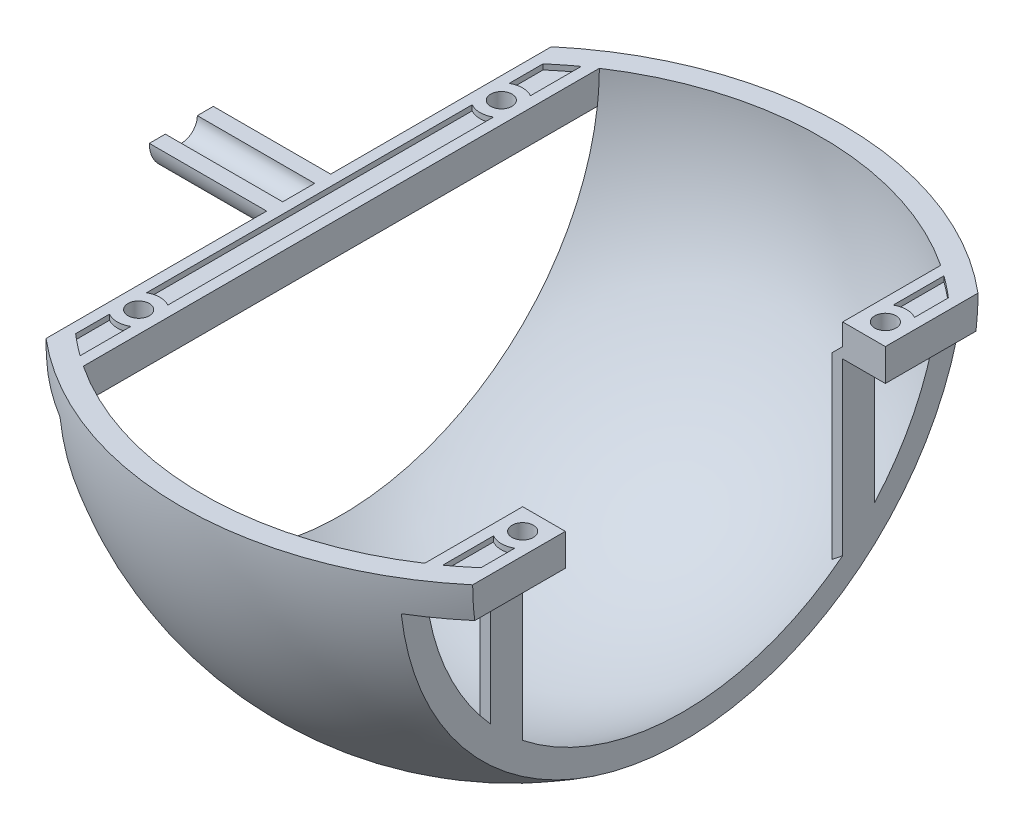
SolidWorks part; units mm, degrees
ref_plane "Plan de face" through (0, 0, 0) normal (0, 0, 1) x (1, 0, 0)
ref_plane "Plan de dessus" through (0, 0, 0) normal (0, 1, 0) x (1, 0, 0)
ref_plane "Plan de droite" through (0, 0, 0) normal (1, 0, 0) x (0, 0, -1)
sketch "Esquisse1" plane through (0, 0, 0) normal (0, 0, 1) x (1, 0, 0)
  line L0 (-40.0294, 0) -> (38.3658, 0) construction
  line L1 (-20, 0) -> (20, 0)
  line L2 (0, 0) -> (0, 37.8329) construction
  line L3 (20, 23.6854) -> (20, 0)
  line L4 (-20, 23.6854) -> (-20, 0)
  arc A0 (20, 23.6854) -> (-20, 23.6854) centre (0, 0) ccw
  dimension "D1" = 31
  dimension "D2" = 40
revolve "Révolution1" add sketch "Esquisse1" angle 360 about L0
sketch "Esquisse2" plane through (0, 0, 0) normal (1, 0, 0) x (0, 0, -1)
  line L0 (-37.5163, 0) -> (36.1663, 0)
extrude "Enlèv. mat.-Extru.1" cut sketch "Esquisse2" against normal through all and the other way through all
sketch "Esquisse3" plane through (0, 0, 0) normal (0, 0, 1) x (1, 0, 0)
  line L0 (20, -23.6854) -> (20, 0) construction
  line L1 (20, -23.6854) -> (20, -3)
  line L2 (-20, 0) -> (-20, -23.6854) construction
  line L3 (-20, -3) -> (-20, -23.6854)
  line L4 (0, 0) -> (0, -18.8748) construction
  line L5 (20, -3) -> (16, -3)
  line L6 (16, -3) -> (16, -26.5518)
  line L7 (-16, -3) -> (-16, -26.5518)
  line L8 (-20, -3) -> (-16, -3)
  line L9 (20, 0) -> (-20, 0) construction
  arc A0 (-20, -23.6854) -> (20, -23.6854) centre (0, 0) ccw construction
  arc A1 (-20, -23.6854) -> (-16, -26.5518) centre (0, 0) ccw
  arc A2 (16, -26.5518) -> (20, -23.6854) centre (0, 0) ccw
  dimension "D1" = 32
  dimension "D2" = 3
extrude "Enlèv. mat.-Extru.2" cut sketch "Esquisse3" against normal through all and the other way through all
sketch "Esquisse4" plane through (0, 0, 0) normal (0, 0, 1) x (1, 0, 0)
  line L0 (20, 0) -> (-20, 0) construction
  line L1 (21.7251, 0) -> (-21.2095, 0) construction
  line L4 (16, -26.5518) -> (16, -3) construction
  line L5 (-16, 0) -> (-16, -24.1868)
  line L6 (16, 0) -> (-16, 0)
  line L7 (-16, -3) -> (-16, -26.5518) construction
  line L8 (16, -24.1868) -> (16, 0)
  arc A2 (-14.9677, -24.8388) -> (14.9677, -24.8388) centre (0, 0) ccw
  arc A3 (-16, -24.1868) -> (16, -24.1868) centre (0, 0) ccw
  dimension "D1" = 2
revolve "Enlèvement de matière-Révolution1" cut sketch "Esquisse4" angle 360 about L1
sketch "Esquisse5" plane through (16, 0, 0) normal (1, 0, 0) x (0, 0, -1)
  line L0 (-23.6854, 0) -> (23.6854, 0) construction
  line L1 (-15, 0) -> (15, 0)
  line L2 (-15, 0) -> (-15, -3)
  line L3 (-15, -3) -> (15, -3)
  line L4 (15, 0) -> (15, -3)
  line L5 (-23.4947, -3) -> (23.4947, -3) construction
  dimension "D1" = 30
extrude "Enlèv. mat.-Extru.3" cut sketch "Esquisse5" along normal up to next
sketch "Esquisse6" plane through (0, 0, 0) normal (0, 1, 0) x (-1, 0, 0)
  line L0 (-18, 15) -> (-18, 20.7536) construction
  line L1 (-20, 15) -> (-16, 15) construction
  line L2 (0, 0) -> (-24.2669, 0) construction
  circle A0 centre (-18, -17) radius 1
  circle A1 centre (-18, 17) radius 1
  dimension "D1" = 2
  dimension "D2" = 34
extrude "Enlèv. mat.-Extru.4" cut sketch "Esquisse6" against normal up to next
mirror "Symétrie1" about plane through (0, 0, 0) normal (1, 0, 0) of "Enlèv. mat.-Extru.4"
sketch "Esquisse7" plane through (0, 0, 0) normal (0, 1, 0) x (-1, 0, 0)
  line L15 (-19, -15) -> (-19, -23.6854)
  line L16 (-19, -18.7321) -> (-19, -21.9089)
  line L18 (-17, -24.1868) -> (-17, -15)
  line L19 (-17, -23.4947) -> (-17, -18.7321)
  arc A0 (-16, -24.1868) -> (16, -24.1868) centre (0, 0) ccw construction
  arc A1 (-19, -21.9089) -> (-17, -23.4947) centre (0, 0) ccw
  circle A4 centre (-18, -17) radius 2
  arc A5 (-19, -18.7321) -> (-17, -18.7321) centre (-18, -17) ccw
  dimension "D1" = 1
  dimension "D2" = 1
  dimension "D3" = 1
extrude "Enlèv. mat.-Extru.5" cut sketch "Esquisse7" against normal blind 0.5
sketch "Esquisse8" plane through (0, -3, 0) normal (0, -1, 0) x (1, 0, 0)
  line L2 (19, -21.9089) -> (19, -18.7321)
  line L3 (17, -18.7321) -> (17, -23.4947)
  line L4 (19, -21.9089) -> (19, -18.7321)
  line L5 (17, -18.7321) -> (17, -23.4947)
  arc A2 (17, -23.4947) -> (19, -21.9089) centre (0, 0) ccw
  arc A3 (17, -18.7321) -> (19, -18.7321) centre (18, -17) ccw
  arc A4 (17, -23.4947) -> (19, -21.9089) centre (0, 0) ccw
  arc A5 (17, -18.7321) -> (19, -18.7321) centre (18, -17) ccw
  dimension "D1" = 0
extrude "Enlèv. mat.-Extru.6" cut sketch "Esquisse8" against normal blind 0.5
ref_plane "Plan1" through (0, -2, 0) normal (0, 1, 0) x (-1, 0, 0)
sketch "Esquisse9" plane through (0, -2, 0) normal (0, 1, 0) x (-1, 0, 0)
  line L1 (-16, -15) -> (-15, -15)
  line L2 (-16, -15) -> (-16, -18)
  line L3 (-16, -18) -> (-15, -18)
  line L4 (-15, -15) -> (-15, -18)
  dimension "D1" = 1
  dimension "D2" = 3
extrude "Extrusion1" add sketch "Esquisse9" against normal up to next
chamfer "Chanfrein1" distance 1 angle 45 1 edges at (15, -2, -16.5)
mirror "Symétrie3" about plane through (0, 0, 0) normal (0, 0, 1) of "Chanfrein1", "Extrusion1", "Enlèv. mat.-Extru.6", "Enlèv. mat.-Extru.5"
sketch "Esquisse10" plane through (0, 0, 0) normal (0, 1, 0) x (-1, 0, 0)
  line L2 (17, 24.1868) -> (17, -24.1868)
  line L3 (17, 23.4947) -> (17, 18.7321)
  line L4 (17, 15.2679) -> (17, -15.2679)
  line L5 (19, -23.6854) -> (19, 23.6854)
  line L6 (19, -21.9089) -> (19, -18.7321)
  line L7 (19, 18.7321) -> (19, 21.9089)
  line L8 (17, -18.7321) -> (17, -23.4947)
  line L9 (19, -15.2679) -> (19, 15.2679)
  arc A0 (-16, -24.1868) -> (16, -24.1868) centre (0, 0) ccw construction
  arc A1 (17, -23.4947) -> (19, -21.9089) centre (0, 0) ccw
  circle A9 centre (18, -17) radius 2
  arc A10 (19, -15.2679) -> (17, -15.2679) centre (18, -17) ccw
  arc A11 (16, 24.1868) -> (-16, 24.1868) centre (0, 0) ccw construction
  circle A12 centre (18, 17) radius 2
  arc A13 (19, 18.7321) -> (17, 18.7321) centre (18, 17) ccw
  arc A14 (19, 21.9089) -> (17, 23.4947) centre (0, 0) ccw
  arc A15 (17, 15.2679) -> (19, 15.2679) centre (18, 17) ccw
  arc A16 (17, -18.7321) -> (19, -18.7321) centre (18, -17) ccw
  dimension "D1" = 1
  dimension "D2" = 1
  dimension "D3" = 1
  dimension "D4" = 1
extrude "Enlèv. mat.-Extru.7" cut sketch "Esquisse10" against normal blind 0.5
sketch "Esquisse11" plane through (0, -3, 0) normal (0, -1, 0) x (1, 0, 0)
  line L2 (-19, -18.7321) -> (-19, -21.9089)
  line L3 (-17, -23.4947) -> (-17, -18.7321)
  line L4 (-19, -18.7321) -> (-19, -21.9089)
  line L5 (-17, -23.4947) -> (-17, -18.7321)
  line L6 (-19, 15.2679) -> (-19, -15.2679)
  line L7 (-17, -15.2679) -> (-17, 15.2679)
  line L8 (-19, 15.2679) -> (-19, -15.2679)
  line L9 (-17, -15.2679) -> (-17, 15.2679)
  line L10 (-17, 18.7321) -> (-17, 23.4947)
  line L11 (-19, 21.9089) -> (-19, 18.7321)
  line L12 (-17, 18.7321) -> (-17, 23.4947)
  line L13 (-19, 21.9089) -> (-19, 18.7321)
  arc A2 (-19, -18.7321) -> (-17, -18.7321) centre (-18, -17) ccw
  arc A3 (-19, -21.9089) -> (-17, -23.4947) centre (0, 0) ccw
  arc A4 (-19, -18.7321) -> (-17, -18.7321) centre (-18, -17) ccw
  arc A5 (-19, -21.9089) -> (-17, -23.4947) centre (0, 0) ccw
  arc A6 (-19, 15.2679) -> (-17, 15.2679) centre (-18, 17) ccw
  arc A7 (-17, -15.2679) -> (-19, -15.2679) centre (-18, -17) ccw
  arc A8 (-19, 15.2679) -> (-17, 15.2679) centre (-18, 17) ccw
  arc A9 (-17, -15.2679) -> (-19, -15.2679) centre (-18, -17) ccw
  arc A10 (-17, 23.4947) -> (-19, 21.9089) centre (0, 0) ccw
  arc A11 (-17, 18.7321) -> (-19, 18.7321) centre (-18, 17) ccw
  arc A12 (-17, 23.4947) -> (-19, 21.9089) centre (0, 0) ccw
  arc A13 (-17, 18.7321) -> (-19, 18.7321) centre (-18, 17) ccw
  dimension "D1" = 0
  dimension "D2" = 0
  dimension "D3" = 0
extrude "Enlèv. mat.-Extru.8" cut sketch "Esquisse11" against normal blind 0.5
sketch "Esquisse12" plane through (-20, 0, 0) normal (-1, 0, 0) x (0, 0, 1)
  line L0 (-23.6854, 0) -> (23.6854, 0) construction
  line L1 (-3, 0) -> (-1.5, 0)
  line L2 (-23.4947, -3) -> (23.4947, -3) construction
  line L3 (1.5, 0) -> (3, 0)
  arc A0 (-3, 0) -> (3, 0) centre (0, 0) ccw
  arc A1 (-1.5, 0) -> (1.5, 0) centre (0, 0) ccw
  dimension "D1" = 3
extrude "Extrusion2" add sketch "Esquisse12" along normal blind 11
